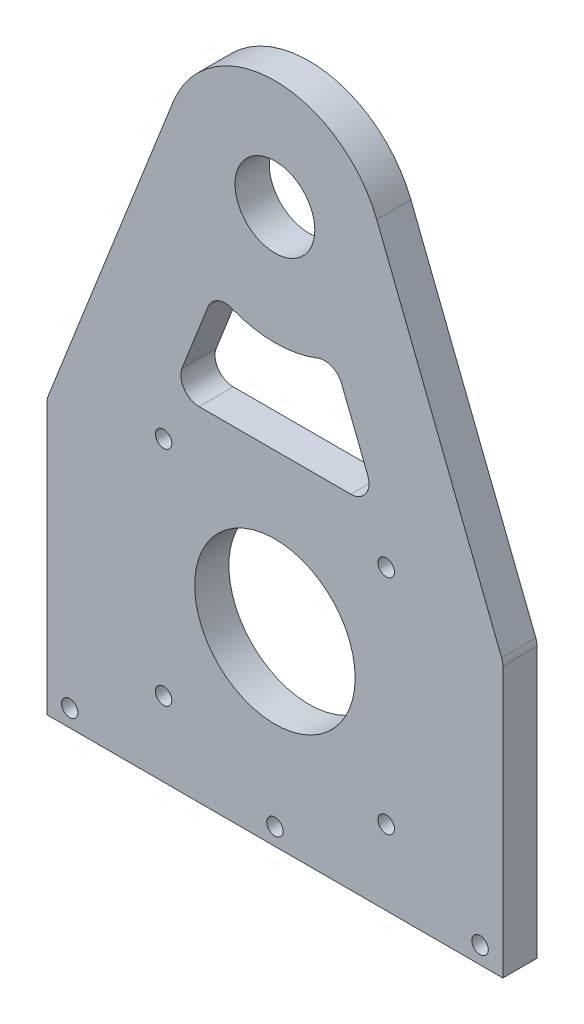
SolidWorks part; units mm, degrees
ref_plane "Front Plane" through (0, 0, 0) normal (0, 0, 1) x (1, 0, 0)
ref_plane "Top Plane" through (0, 0, 0) normal (0, 1, 0) x (1, 0, 0)
ref_plane "Right Plane" through (0, 0, 0) normal (1, 0, 0) x (0, 0, -1)
sketch "Sketch1" plane through (0, 0, 0) normal (0, 0, 1) x (1, 0, 0)
  line L0 (-31.75, 0) -> (31.75, 0)
  line L1 (31.75, 0) -> (31.75, 38.1)
  line L2 (31.75, 38.1) -> (14.1794, 82.7027)
  line L3 (0, 0) -> (0, 126.9546) construction
  line L4 (-31.75, 0) -> (-31.75, 38.1)
  line L5 (-31.75, 38.1) -> (-14.1794, 82.7027)
  arc A0 (-14.1794, 82.7027) -> (14.1794, 82.7027) centre (0, 77.1169) cw
  dimension "D3" = 77.1169
  dimension "D4" = 15.24
  dimension "D1" = 63.5
  dimension "D2" = 38.1
extrude "Boss-Extrude1" add sketch "Sketch1" along normal blind 4.7625
sketch "Sketch2" plane through (0, 0, 4.7625) normal (0, 0, 1) x (1, 0, 0)
  line L0 (0, 92.3569) -> (0, 0) construction
  line L1 (-31.75, 0) -> (31.75, 0) construction
  line L2 (-31.75, 38.1) -> (-31.75, 0) construction
  circle A0 centre (-28.575, 2.3813) radius 1.143
  arc A1 (14.1794, 82.7027) -> (-14.1794, 82.7027) centre (0, 77.1169) ccw construction
  circle A2 centre (28.575, 2.3813) radius 1.143
  circle A3 centre (0, 2.3813) radius 1.143
  dimension "D3" = 2.286
  dimension "D1" = 2.3813
  dimension "D2" = 3.175
extrude "Cut-Extrude1" cut sketch "Sketch2" against normal through all
sketch "Sketch3" plane through (0, 0, 4.7625) normal (0, 0, 1) x (1, 0, 0)
  line L0 (-31.75, 4.7625) -> (31.75, 4.7625) construction
  line L1 (-31.75, 38.1) -> (-31.75, 0) construction
  line L2 (31.75, 0) -> (31.75, 38.1) construction
  line L3 (-31.75, 0) -> (31.75, 0) construction
  line L5 (-15.5, 10.4131) -> (15.5, 10.4131) construction
  line L6 (-15.5, 10.4131) -> (-15.5, 41.4131) construction
  line L7 (-15.5, 41.4131) -> (15.5, 41.4131) construction
  line L8 (15.5, 10.4131) -> (15.5, 41.4131) construction
  line L9 (-15.5, 10.4131) -> (15.5, 41.4131) construction
  line L10 (-15.5, 41.4131) -> (15.5, 10.4131) construction
  circle A0 centre (0, 25.9131) radius 11.176
  circle A1 centre (-15.5, 41.4131) radius 1.143
  circle A2 centre (15.5, 41.4131) radius 1.143
  circle A3 centre (15.5, 10.4131) radius 1.143
  circle A4 centre (-15.5, 10.4131) radius 1.143
  dimension "D2" = 22.352
  dimension "D5" = 2.286
  dimension "D1" = 4.7625
  dimension "D3" = 21.1506
  dimension "D4" = 31
extrude "Cut-Extrude2" cut sketch "Sketch3" against normal through all
sketch "Sketch5" plane through (0, 0, 4.7625) normal (0, 0, 1) x (1, 0, 0)
  circle A0 centre (0, 77.1169) radius 5.5562
  circle A1 centre (0, 25.9131) radius 11.176 construction
  dimension "D2" = 11.1125
  dimension "D1" = 51.2039
extrude "Cut-Extrude3" cut sketch "Sketch5" against normal through all
sketch "Sketch6" plane through (0, 0, 4.7625) normal (0, 0, 1) x (1, 0, 0)
  line L0 (31.75, 38.1) -> (14.1794, 82.7027) construction
  line L1 (-14.1794, 82.7027) -> (-31.75, 38.1) construction
  line L2 (-14.1794, 82.7027) -> (-31.75, 38.1) construction
  line L3 (31.75, 38.1) -> (14.1794, 82.7027) construction
  line L4 (-8.2911, 63.0002) -> (-14.2935, 47.7631)
  line L5 (14.2935, 47.7631) -> (8.2911, 63.0002)
  line L6 (-2.3632, 78.0479) -> (-19.9338, 33.4452) construction
  line L7 (19.9338, 33.4452) -> (2.3632, 78.0479) construction
  line L8 (-14.2935, 47.7631) -> (14.2935, 47.7631)
  circle A0 centre (-15.5, 41.4131) radius 1.143 construction
  arc A1 (-8.2911, 63.0002) -> (8.2911, 63.0002) centre (0, 77.1169) ccw
  dimension "D2" = 6.35
  dimension "D3" = 16.3715
  dimension "D1" = 12.7
extrude "Cut-Extrude4" cut sketch "Sketch6" against normal through all
fillet "Fillet1" radius 2.54 6 edges at (31.75, 38.1, 2.3813) (-31.75, 38.1, 2.3813) (14.2935, 47.7631, 2.3813) (-14.2935, 47.7631, 2.3813) (8.2911, 63.0002, 2.3813) (-8.2911, 63.0002, 2.3813)
